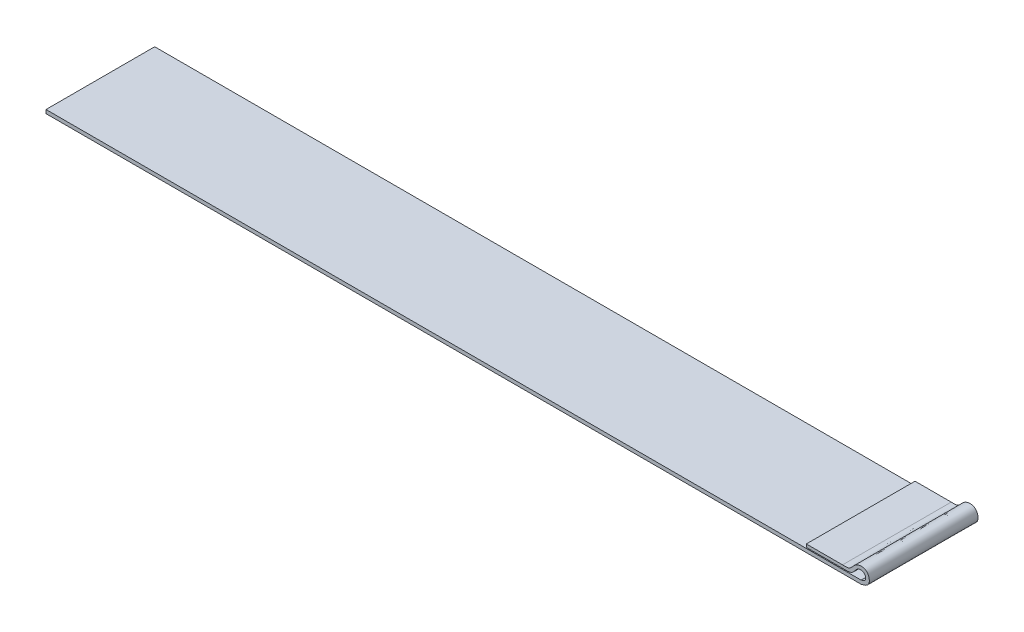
SolidWorks part; units mm, degrees
ref_plane "Front Plane" through (0, 0, 0) normal (0, 0, 1) x (1, 0, 0)
ref_plane "Top Plane" through (0, 0, 0) normal (0, 1, 0) x (1, 0, 0)
ref_plane "Right Plane" through (0, 0, 0) normal (1, 0, 0) x (0, 0, -1)
sketch "Sketch1" plane through (0, 0, 0) normal (0, 0, 1) x (1, 0, 0)
  line L0 (0, 0) -> (-571.5, 0)
  line L1 (-571.5, 0) -> (-571.5, -2.54)
  line L2 (-571.5, -2.54) -> (0.1792, -2.54)
  line L3 (-13.022, 2.7492) -> (-38.422, 2.7492)
  line L4 (-13.022, 0.6622) -> (-38.422, 0.6622)
  line L5 (-38.422, 2.7492) -> (-38.422, 0.6622)
  spline S0 degree 3 poles (0, 0) (1.298, 0.4055) (3.9753, 1.242) (2.4405, 6.5913) (-3.2439, 6.0614) (-5.7467, 0.3654) (-10.2885, 0.5507) (-13.022, 0.6622) knots 0 0 0 0 0.147508 0.304262 0.492001 0.694253 1 1 1 1
  spline S1 degree 3 poles (0.1792, -2.54) (2.1628, -2.0029) (6.8136, -0.7437) (5.0462, 9.6318) (-4.3154, 8.3773) (-7.4499, 2.5725) (-11.1159, 2.6888) (-13.022, 2.7492) knots 0 0 0 0 0.177068 0.415141 0.676772 0.831936 1 1 1 1
  dimension "D1" = 571.6792
extrude "Extrude1" add sketch "Sketch1" along normal blind 76.2
